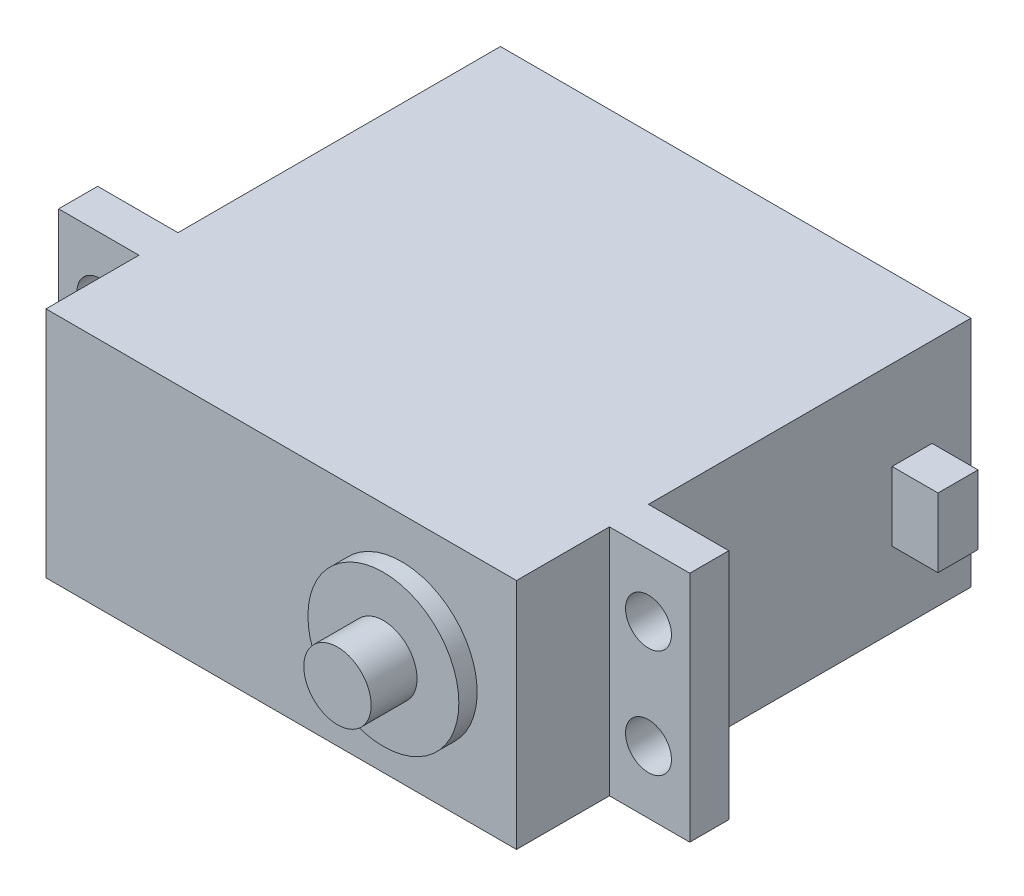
SolidWorks part; units mm, degrees
ref_plane "前视基准面" through (0, 0, 0) normal (0, 0, 1) x (1, 0, 0)
ref_plane "上视基准面" through (0, 0, 0) normal (0, 1, 0) x (1, 0, 0)
ref_plane "右视基准面" through (0, 0, 0) normal (1, 0, 0) x (0, 0, -1)
sketch "草图1" plane through (0, 0, 0) normal (0, 1, 0) x (1, 0, 0)
  line L0 (20.5, 39.6) -> (20.5, 29.9942)
  line L1 (0, 0) -> (41, 0)
  line L2 (0, 0) -> (0, 39.6)
  line L3 (0, 39.6) -> (41, 39.6)
  line L4 (41, 0) -> (41, 39.6)
  line L5 (0, 8.1) -> (-7, 8.1)
  line L6 (0, 8.1) -> (0, 11.5)
  line L7 (0, 11.5) -> (-7, 11.5)
  line L8 (-7, 8.1) -> (-7, 11.5)
  line L9 (48, 8.1) -> (48, 11.5)
  line L10 (41, 11.5) -> (48, 11.5)
  line L11 (41, 8.1) -> (41, 11.5)
  line L12 (41, 8.1) -> (48, 8.1)
  dimension "D1" = 41
  dimension "D2" = 39.6
  dimension "D3" = 8.1
  dimension "D4" = 3.4
  dimension "D5" = 7
extrude "凸台-拉伸1" add sketch "草图1" along normal blind 20.3
sketch "草图2" plane through (0, 0, 0) normal (0, 0, 1) x (1, 0, 0)
  line L0 (41, 10.15) -> (-2.836, 10.15)
  line L4 (0, 0) -> (41, 0)
  line L5 (41, 0) -> (41, 20.3)
  line L6 (41, 20.3) -> (0, 20.3)
  line L7 (0, 20.3) -> (0, 0)
  line L8 (0, 0) -> (41, 0)
  line L9 (41, 0) -> (41, 20.3)
  line L10 (41, 20.3) -> (0, 20.3)
  line L11 (0, 20.3) -> (0, 0)
  circle A0 centre (31, 10.15) radius 6.575
  dimension "D2" = 10
  dimension "D3" = 13.15
  dimension "D1" = 0
extrude "凸台-拉伸2" add sketch "草图2" along normal blind 1.6 contours L0 A0 | L0 A0
sketch "草图3" plane through (0, 0, 1.6) normal (0, 0, 1) x (1, 0, 0)
  circle A0 centre (31, 10.15) radius 2.935
  dimension "D2" = 5.87
extrude "凸台-拉伸3" add sketch "草图3" along normal blind 4
sketch "草图4" plane through (0, 0, -8.1) normal (0, 0, 1) x (1, 0, 0)
  line L0 (48, 10.15) -> (41, 10.15)
  line L1 (20.5, 20.3) -> (20.5, 13.8383)
  line L4 (41, 0) -> (48, 0)
  line L5 (48, 0) -> (48, 20.3)
  line L6 (48, 20.3) -> (41, 20.3)
  line L7 (41, 20.3) -> (41, 0)
  line L8 (41, 0) -> (48, 0)
  line L9 (48, 0) -> (48, 20.3)
  line L10 (48, 20.3) -> (41, 20.3)
  line L13 (0, 0) -> (41, 0)
  line L14 (41, 0) -> (41, 20.3)
  line L15 (41, 20.3) -> (0, 20.3)
  line L16 (0, 20.3) -> (0, 0)
  line L18 (41, 0) -> (41, 20.3)
  line L19 (41, 20.3) -> (0, 20.3)
  circle A0 centre (44.4, 5.45) radius 2
  circle A1 centre (44.4, 14.85) radius 2
  circle A2 centre (-3.4, 5.45) radius 2
  circle A3 centre (-3.4, 14.85) radius 2
  dimension "D2" = 4
  dimension "D3" = 4.7
  dimension "D4" = 3.6
  dimension "D1" = 0
  dimension "D5" = 0
extrude "切除-拉伸1" cut sketch "草图4" against normal through all contours A3 | A2 | A1 | A0
sketch "草图5" plane through (41, 0, 0) normal (1, 0, 0) x (0, 0, -1)
  line L1 (32.7313, 12.5393) -> (36.2169, 12.5393)
  line L2 (32.7313, 12.5393) -> (32.7313, 6.5239)
  line L3 (32.7313, 6.5239) -> (36.2169, 6.5239)
  line L4 (36.2169, 12.5393) -> (36.2169, 6.5239)
extrude "凸台-拉伸4" add sketch "草图5" along normal blind 4
